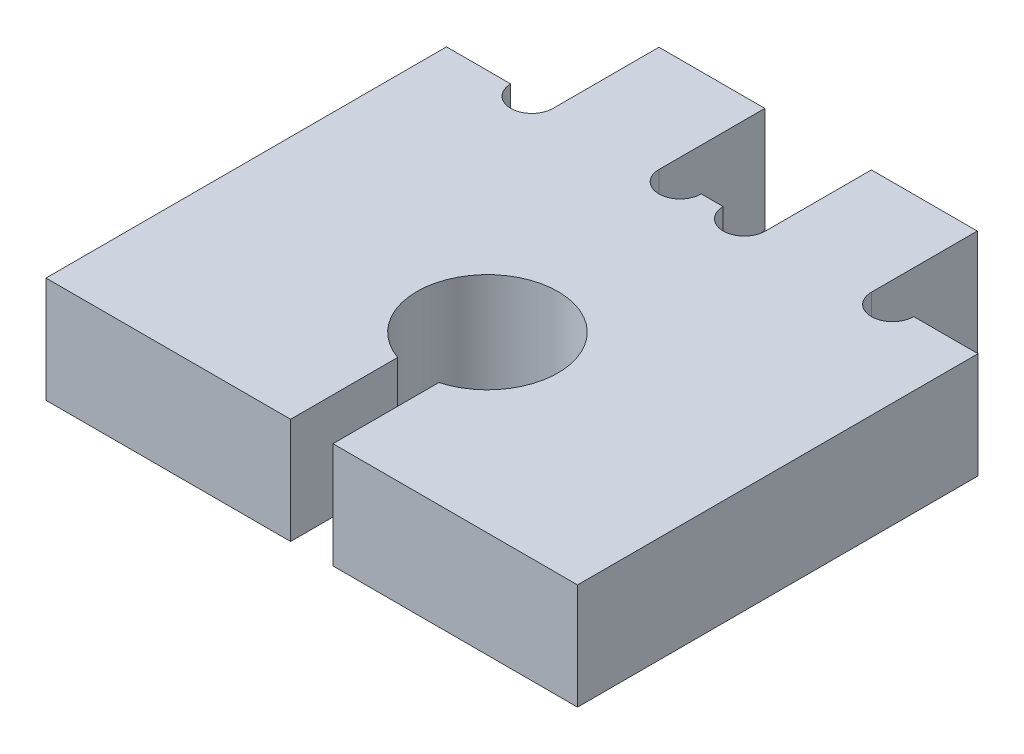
SolidWorks part; units mm, degrees
ref_plane "Ebene vorne" through (0, 0, 0) normal (0, 0, 1) x (1, 0, 0)
ref_plane "Ebene oben" through (0, 0, 0) normal (0, 1, 0) x (1, 0, 0)
ref_plane "Ebene rechts" through (0, 0, 0) normal (1, 0, 0) x (0, 0, -1)
sketch "Skizze1" plane through (0, 0, 0) normal (0, 1, 0) x (1, 0, 0)
  line L0 (0, 0) -> (0, 56.7342)
  line L1 (0, 56.7342) -> (9.1, 56.7342)
  line L2 (15.1, 56.7342) -> (15.1, 71.7342)
  line L3 (15.1, 71.7342) -> (30.1, 71.7342)
  line L4 (30.1, 71.7342) -> (30.1, 56.7342)
  line L5 (36.1, 56.7342) -> (39.2, 56.7342)
  line L6 (45.2, 56.7342) -> (45.2, 71.7342)
  line L7 (45.2, 71.7342) -> (60.2, 71.7342)
  line L8 (60.2, 71.7342) -> (60.2, 56.7342)
  line L9 (66.2, 56.7342) -> (75.3, 56.7342)
  line L10 (75.3, 56.7342) -> (75.3, 0)
  line L11 (75.3, 0) -> (40.65, 0)
  line L12 (40.65, 0) -> (40.65, 15)
  line L14 (34.65, 15.1672) -> (34.65, 0)
  line L15 (34.65, 0) -> (0, 0)
  arc A0 (9.1, 56.7342) -> (15.1, 56.7342) centre (12.1, 56.7342) ccw
  arc A1 (30.1, 56.7342) -> (36.1, 56.7342) centre (33.1, 56.7342) ccw
  arc A2 (39.2, 56.7342) -> (45.2, 56.7342) centre (42.2, 56.7342) ccw
  arc A3 (60.2, 56.7342) -> (66.2, 56.7342) centre (63.2, 56.7342) ccw
  arc A4 (34.65, 15.1672) -> (40.65, 15) centre (37.9157, 24.6189) cw
  dimension "D3" = 3
  dimension "D4" = 3
  dimension "D5" = 3
  dimension "D6" = 3
  dimension "D15" = 10
  dimension "D2" = 15
  dimension "D7" = 15
  dimension "D8" = 15
  dimension "D9" = 15.1
  dimension "D10" = 15.1
  dimension "D11" = 6
  dimension "D12" = 15.1
  dimension "D13" = 34.65
  dimension "D14" = 34.65
  dimension "D16" = 15
extrude "Aufsatz-Linear austragen1" add sketch "Skizze1" along normal blind 15
